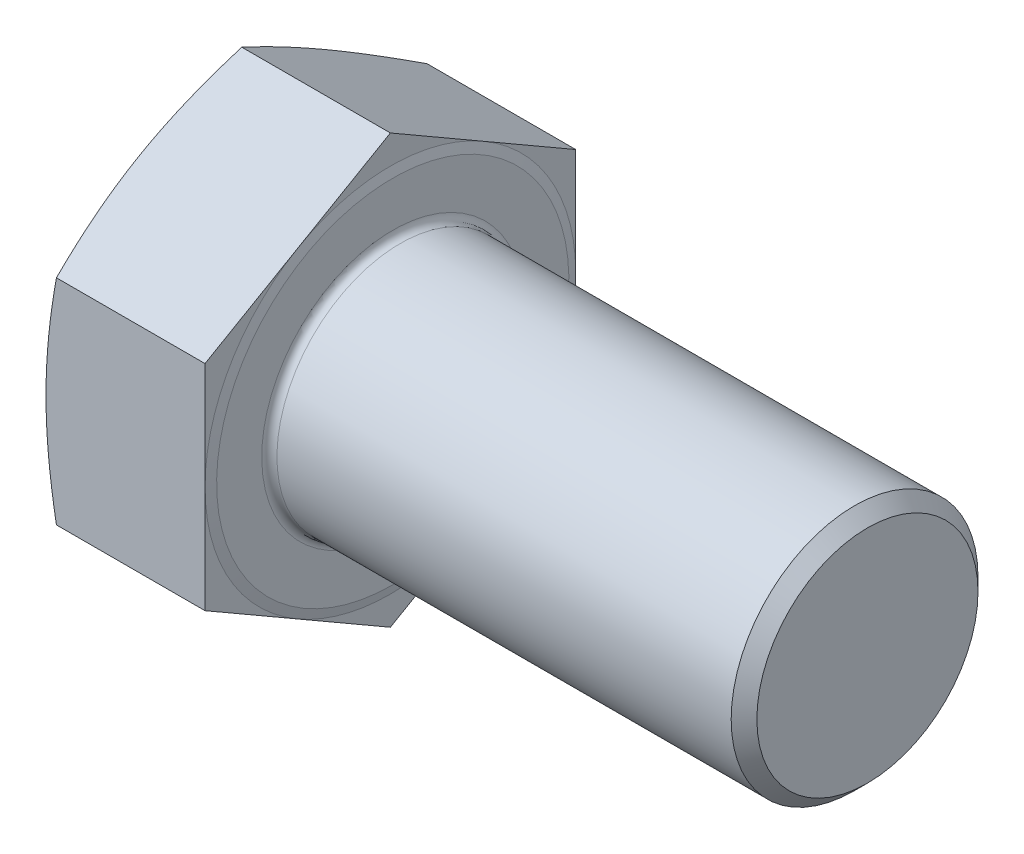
SolidWorks part; units mm, degrees
ref_plane "Front" through (0, 0, 0) normal (0, 0, 1) x (1, 0, 0)
ref_plane "Top" through (0, 0, 0) normal (0, 1, 0) x (1, 0, 0)
ref_plane "Right" through (0, 0, 0) normal (1, 0, 0) x (0, 0, -1)
sketch "Sketch-BaseHead" plane through (0, 0, 0) normal (1, 0, 0) x (0, 0, -1)
  line L1 (0, -45.0911) -> (39.05, -22.5455)
  line L2 (39.05, -22.5455) -> (39.05, 22.5455)
  line L3 (39.05, 22.5455) -> (0, 45.0911)
  line L4 (0, 45.0911) -> (-39.05, 22.5455)
  line L5 (-39.05, 22.5455) -> (-39.05, -22.5455)
  line L6 (-39.05, -22.5455) -> (0, -45.0911)
  circle A0 centre (0, 0) radius 39.05 construction
  dimension "s" = 78.1
extrude "BaseHead" add sketch "Sketch-BaseHead" along normal blind 33.5
sketch "Sketch4" plane through (-0.2646, -5.9169, 0) normal (0, 0, 1) x (0, 1, 0)
  line L0 (5.9169, 3.7369) -> (5.9169, -10.4477) construction
  line L2 (51.008, -0.2646) -> (44.9669, -0.2646)
  line L4 (44.9669, -0.2646) -> (51.008, -2.4634)
  line L6 (51.008, -2.4634) -> (51.008, -0.2646)
  dimension "D1" = 20
  dimension "D2" = 78.1
revolve "HeadChamfer" cut sketch "Sketch4" angle 360 about L0
sketch "Sketch1" plane through (0, 0, 0) normal (0, 1, 0) x (1, 0, 0)
  line L0 (33.5, 0) -> (34, 0)
  line L1 (34, 0) -> (34, 37.1)
  line L2 (34, 37.1) -> (33.5, 39.05)
  line L3 (33.5, 39.05) -> (33.5, 0)
  line L4 (-4.0016, 0) -> (10.1831, 0) construction
  dimension "D1" = 39.05
  dimension "D2" = 37.1
  dimension "D3" = 0.5
revolve "Revolve1" add sketch "Sketch1" angle 360 about axis through (-4.0016, 0, 0) along (1, 0, 0)
sketch "Sketch3" plane through (34, 0, 0) normal (1, 0, 0) x (0, 0, -1)
  circle A0 centre (0, 0) radius 26
  dimension "d" = 52
extrude "BaseBody" add sketch "Sketch3" along normal blind 100
chamfer "Chamfer1" distance 2.7065 angle 45 1 edges at (134, 26, 0)
fillet "HeadFillet" radius 1.6 1 edges at (34, -26, 0)
equation "\"D1@Sketch1\" = \"s@Sketch-BaseHead\" / 2 "
equation "\"D2@Sketch4\" = \"s@Sketch-BaseHead\""
equation "\"D1@Chamfer1\" =  ( \"d@Sketch3\" - \"D2@ThreadCosmetic1\" ) / 2 "
